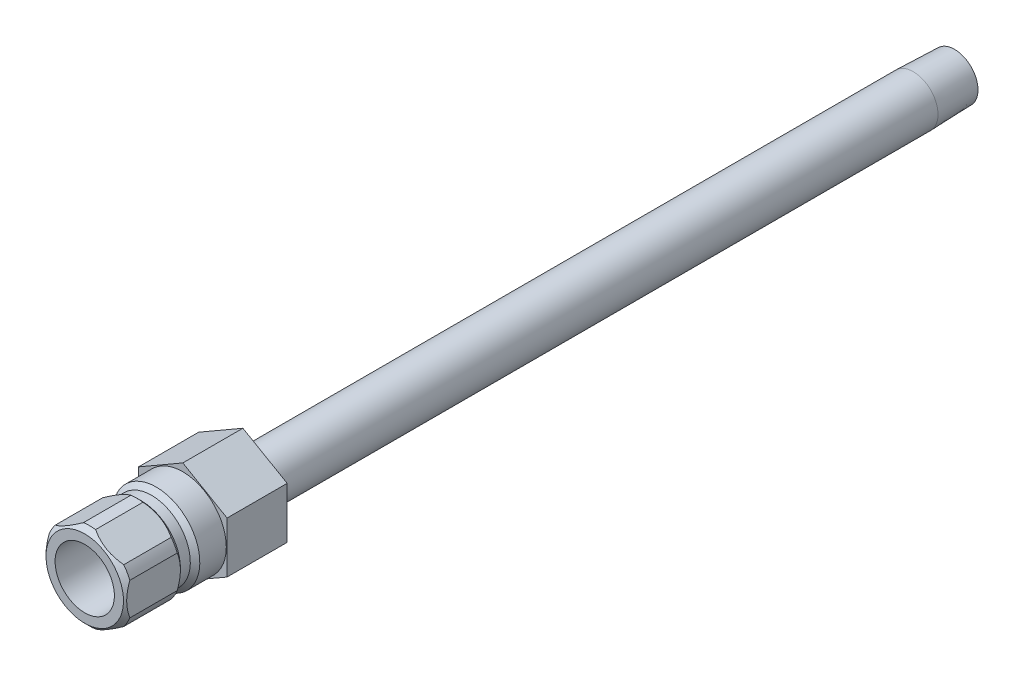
SolidWorks part; units mm, degrees
ref_plane "Front Plane" through (0, 0, 0) normal (0, 0, 1) x (1, 0, 0)
ref_plane "Top Plane" through (0, 0, 0) normal (0, 1, 0) x (1, 0, 0)
ref_plane "Right Plane" through (0, 0, 0) normal (1, 0, 0) x (0, 0, -1)
sketch "Sketch1" plane through (0, 0, 0) normal (1, 0, 0) x (0, 0, -1)
  line L0 (9.652, 0) -> (-18.923, 0) construction
  line L1 (-15.748, 4.7625) -> (-15.748, 6.223)
  line L2 (-6.604, 6.223) -> (-6.604, 0) construction
  line L3 (-14.986, 6.985) -> (-7.366, 6.985)
  line L4 (-3.556, 4.7625) -> (-2.4351, 2.6543)
  line L5 (-6.604, 6.223) -> (-5.0165, 6.223)
  line L6 (-4.2545, 6.985) -> (9.652, 6.985)
  line L7 (9.652, 6.985) -> (9.652, 3.9688)
  line L8 (-6.604, 6.223) -> (-7.366, 6.985)
  line L9 (-5.0165, 6.223) -> (-4.2545, 6.985)
  line L10 (-15.748, 6.223) -> (-14.986, 6.985)
  line L12 (9.652, 3.9688) -> (117.3226, 3.9688)
  line L13 (117.3226, 3.9688) -> (123.952, 3.7616)
  line L14 (123.952, 3.7616) -> (123.952, 2.6543)
  line L16 (9.652, 6.731) -> (9.652, 0) construction
  line L19 (-3.556, 4.7625) -> (-15.748, 4.7625)
  line L20 (-2.4351, 2.6543) -> (123.952, 2.6543)
  dimension "D2" = 1.5875
  dimension "D3" = 0.762
  dimension "D4" = 45
  dimension "D5" = 9.144
  dimension "D6" = 45
  dimension "D7" = 1.79
  dimension "D8" = 6.6294
  dimension "D9" = 139.7
  dimension "D10" = 3.175
  dimension "D11" = 9.525
  dimension "D12" = 7.9375
  dimension "D13" = 25.4
  dimension "D14" = 13.97
  dimension "D15" = 5.3086
  dimension "D16" = 118
  dimension "D17" = 12.192
  dimension "D18" = 15.748
revolve "Revolve1" add sketch "Sketch1" angle 360 about L0
sketch "Sketch2" plane through (0, 0, 0) normal (0, 0, 1) x (1, 0, 0)
  line L1 (-7.112, 4.1061) -> (-7.112, -4.1061)
  line L2 (-7.112, -4.1061) -> (0, -8.2122)
  line L3 (0, -8.2122) -> (7.112, -4.1061)
  line L4 (7.112, -4.1061) -> (7.112, 4.1061)
  line L5 (7.112, 4.1061) -> (0, 8.2122)
  line L6 (0, 8.2122) -> (-7.112, 4.1061)
  circle A0 centre (0, 0) radius 7.112 construction
  circle A2 centre (0, 0) radius 2.6543
  circle A3 centre (0, 0) radius 2.6543 construction
  dimension "D1" = 14.224
extrude "Boss-Extrude1" add sketch "Sketch2" against normal up to vertex (9.652 mm away)
sketch "Sketch3" plane through (0, 0, 0) normal (0, 0, 1) x (1, 0, 0)
  line L1 (6.477, 3.7395) -> (0, 7.479)
  line L2 (0, 7.479) -> (-6.477, 3.7395)
  line L3 (-6.477, 3.7395) -> (-6.477, -3.7395)
  line L4 (-6.477, -3.7395) -> (0, -7.479)
  line L5 (0, -7.479) -> (6.477, -3.7395)
  line L6 (6.477, -3.7395) -> (6.477, 3.7395)
  circle A0 centre (0, 0) radius 6.477 construction
  dimension "D1" = 12.954
extrude "Cut-Extrude1" cut sketch "Sketch3" along normal through all from vertex at 6.604 flip side to cut
